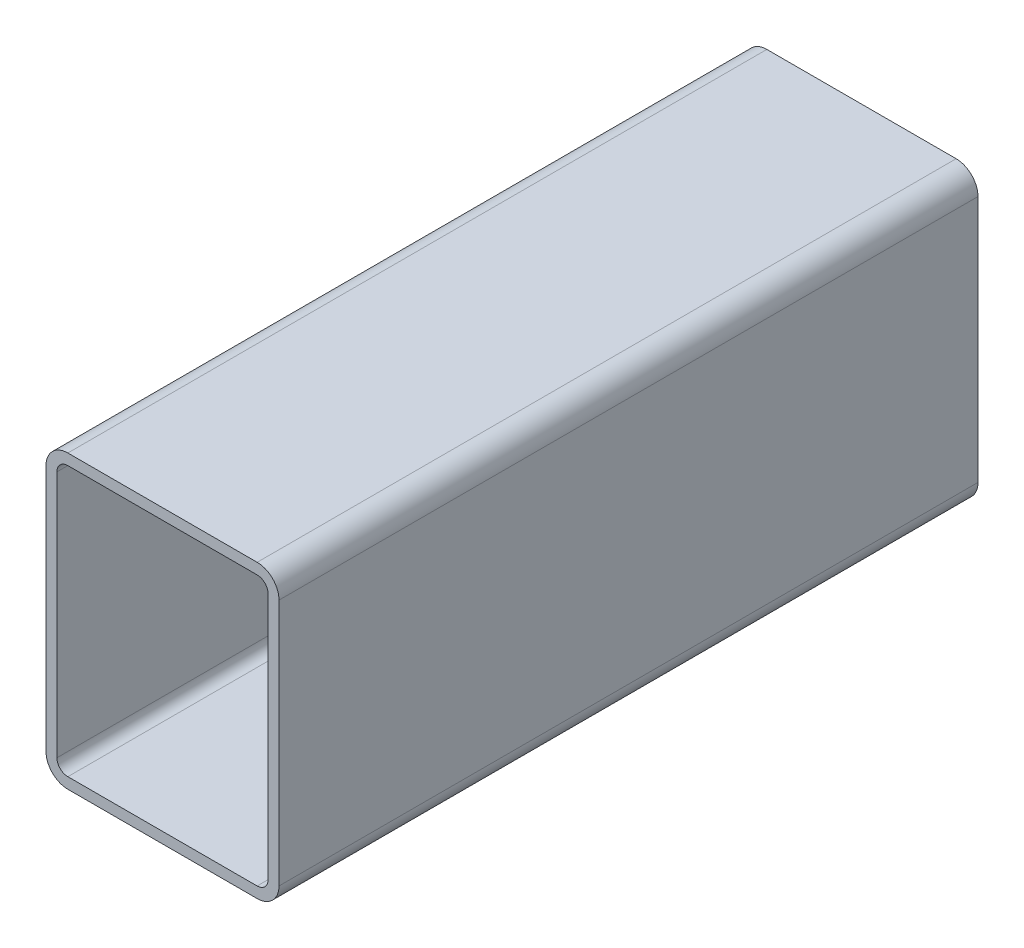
SolidWorks part; units mm, degrees
ref_plane "Front Plane" through (0, 0, 0) normal (0, 0, 1) x (1, 0, 0)
ref_plane "Top Plane" through (0, 0, 0) normal (0, 1, 0) x (1, 0, 0)
ref_plane "Right Plane" through (0, 0, 0) normal (1, 0, 0) x (0, 0, -1)
sketch "Sketch1" plane through (0, 0, 0) normal (0, 0, 1) x (1, 0, 0)
sketch_block_instance "HSS5x4x0.1875-1"
sketch_block "HSS5x4x0.1875"
extrude "Boss-Extrude1" add sketch "Sketch1" along normal blind 304.8
